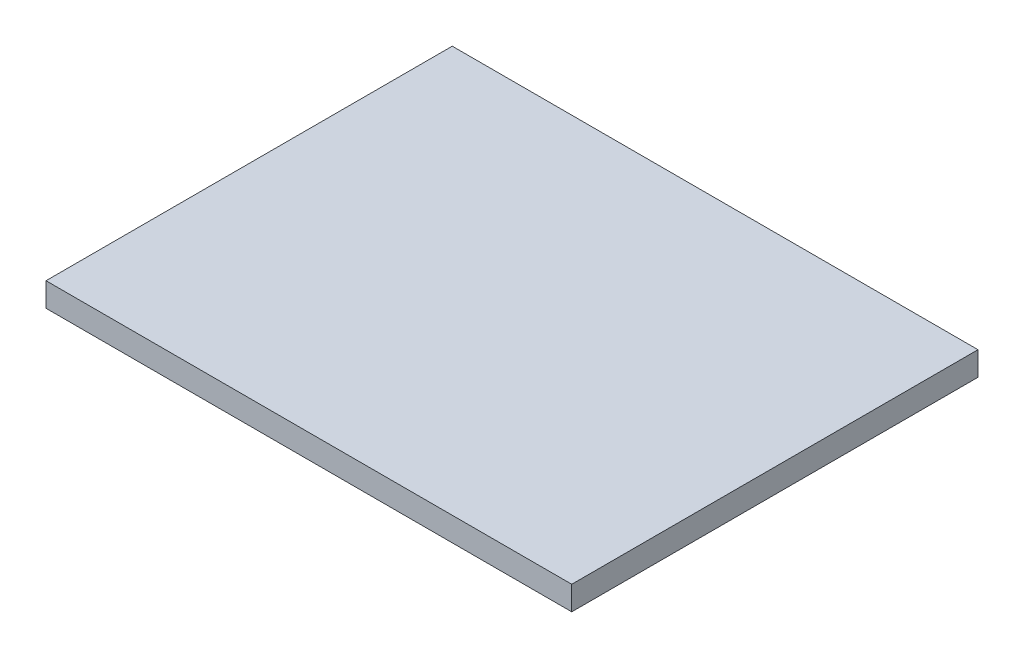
SolidWorks part; units mm, degrees
ref_plane "Front Plane" through (0, 0, 0) normal (0, 0, 1) x (1, 0, 0)
ref_plane "Top Plane" through (0, 0, 0) normal (0, 1, 0) x (1, 0, 0)
ref_plane "Right Plane" through (0, 0, 0) normal (1, 0, 0) x (0, 0, -1)
sketch "Sketch1" plane through (0, 0, 0) normal (0, 1, 0) x (1, 0, 0)
  line L1 (0, 0) -> (110, 0)
  line L2 (0, 0) -> (0, 85)
  line L3 (0, 85) -> (110, 85)
  line L4 (110, 0) -> (110, 85)
  dimension "D1" = 110
  dimension "D2" = 85
extrude "Extrude1" add sketch "Sketch1" along normal blind 5
